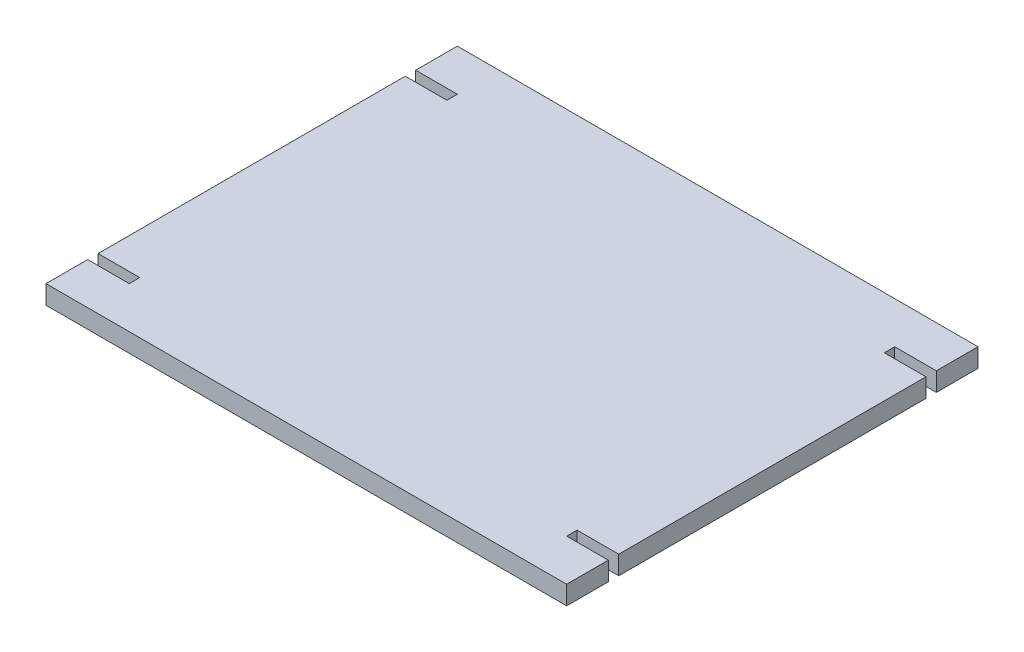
SolidWorks part; units mm, degrees
ref_plane "Front Plane" through (0, 0, 0) normal (0, 0, 1) x (1, 0, 0)
ref_plane "Top Plane" through (0, 0, 0) normal (0, 1, 0) x (1, 0, 0)
ref_plane "Right Plane" through (0, 0, 0) normal (1, 0, 0) x (0, 0, -1)
sketch "Sketch1" plane through (0, 0, 0) normal (0, 1, 0) x (1, 0, 0)
  line L0 (-301.875, 208.2292) -> (198.125, 208.2292)
  line L1 (198.125, 208.2292) -> (198.125, 168.2292)
  line L2 (198.125, 168.2292) -> (158.125, 168.2292)
  line L3 (158.125, 168.2292) -> (158.125, 158.2292)
  line L4 (158.125, 158.2292) -> (198.125, 158.2292)
  line L5 (198.125, 158.2292) -> (198.125, -136.7708)
  line L6 (198.125, -136.7708) -> (158.125, -136.7708)
  line L7 (158.125, -136.7708) -> (158.125, -146.7708)
  line L8 (158.125, -146.7708) -> (198.125, -146.7708)
  line L9 (198.125, -146.7708) -> (198.125, -186.7708)
  line L10 (198.125, -186.7708) -> (-301.875, -186.7708)
  line L11 (-301.875, -186.7708) -> (-301.875, -146.7708)
  line L12 (-301.875, -146.7708) -> (-261.875, -146.7708)
  line L13 (-261.875, -146.7708) -> (-261.875, -136.7708)
  line L14 (-261.875, -136.7708) -> (-301.875, -136.7708)
  line L15 (-301.875, -136.7708) -> (-301.875, 158.2292)
  line L16 (-301.875, 158.2292) -> (-261.875, 158.2292)
  line L17 (-261.875, 158.2292) -> (-261.875, 168.2292)
  line L18 (-261.875, 168.2292) -> (-301.875, 168.2292)
  line L19 (-301.875, 168.2292) -> (-301.875, 208.2292)
  dimension "D1" = 10
  dimension "D2" = 40
  dimension "D3" = 40
  dimension "D4" = 395
  dimension "D5" = 500
extrude "Boss-Extrude1" add sketch "Sketch1" along normal blind 18
